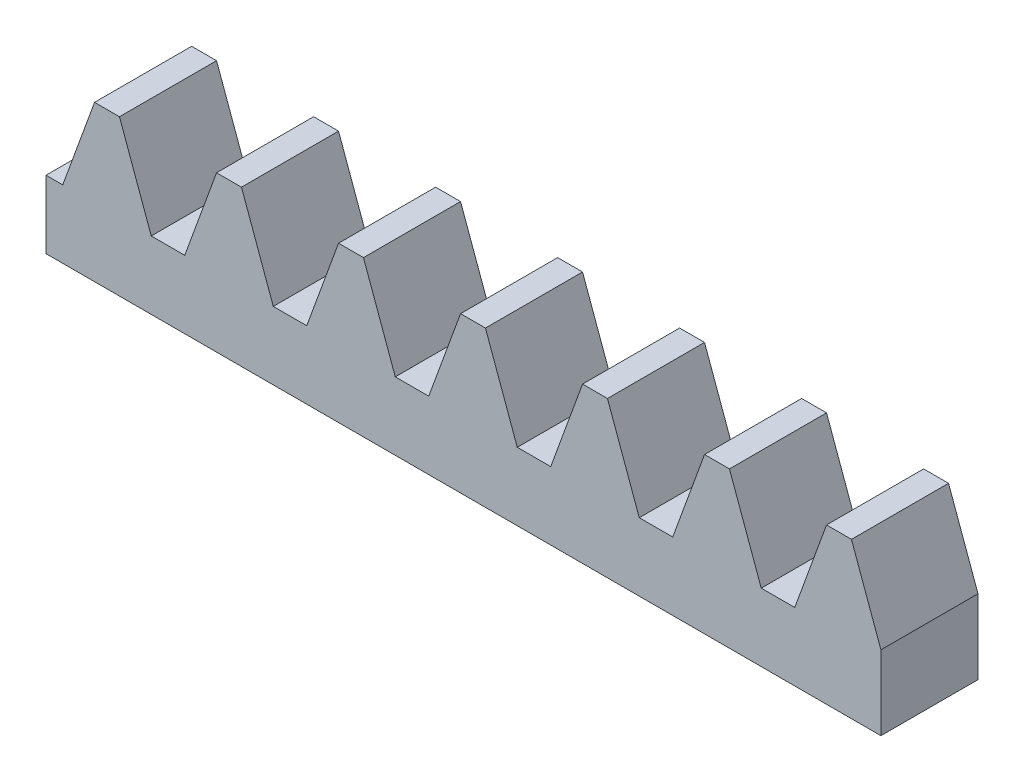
SolidWorks part; units mm, degrees
ref_plane "Plane1" through (0, 0, 0) normal (0, 0, 1) x (1, 0, 0)
ref_plane "Plane2" through (0, 0, 0) normal (0, 1, 0) x (1, 0, 0)
ref_plane "Plane3" through (0, 0, 0) normal (1, 0, 0) x (0, 0, -1)
sketch "HoldingSke" plane through (0, 0, 0) normal (0, 1, 0) x (1, 0, 0)
  line L0 (0, 0) -> (0.0696, 0.4951)
  line L1 (-15, 0) -> (100, 0) construction
  line L2 (0, 0) -> (-2.1039, 2.3779)
  line L3 (0, 0) -> (-11.863, 4.5341)
  line L4 (0, 0) -> (8.552, 1.2019)
  line L5 (0, 0) -> (-23.7986, -8.8762)
  line L6 (0, 0) -> (-10.5278, -7.1032)
  line L9 (-71.009, 38.7566) -> (-30.6022, 53.4635)
  line L10 (-76.2, 4.3779) -> (-70.2, 4.3779)
  line L11 (0, 0) -> (-5, 0)
  line L12 (-76.2, 101.6) -> (-76.133, 101.6)
  line L13 (24.9733, 27.94) -> (52.9518, 28.4284)
  line L14 (24.9733, 27.94) -> (24.9743, 27.94)
  line L15 (24.9733, 27.94) -> (100.4006, 29.5858)
  circle A0 centre (0, 0) radius 19.05
  circle A1 centre (0, 0) radius 3
  circle A2 centre (0, 0) radius 12.7
  dimension "MPH" = 6
  dimension "Diameter" = 38.1
  dimension "Num_teeth" = 8
  dimension "Pitch" = 0.5
  dimension "Width" = 5
  dimension "Show_teeth" = 998
  dimension "Thickness" = 12.7
  dimension "Ap" = 20
  dimension "Pitch_height" = 6
  dimension "Backlash" = 0.067
  dimension "Addendum_fac" = 1
  dimension "Dedendum_fac" = 1.25
  dimension "Clearance_fac" = 0.25
  dimension "Dedendum_add" = 0.001
  dimension "Length" = 43
  dimension "Module" = 2
sketch "BlankSke" plane through (0, 0, 0) normal (0, 0, 1) x (1, 0, 0)
  line L1 (0, 0) -> (43, 0)
  line L2 (0, 0) -> (0, 8)
  line L3 (0, 8) -> (43, 8)
  line L4 (43, 0) -> (43, 8)
  dimension "Length" = 43
  dimension "Blank_height" = 8
extrude "Blank" add sketch "BlankSke" against normal blind 5
sketch "TooCutSkeIll" plane through (0, 0, 0) normal (0, 0, 1) x (1, 0, 0)
  line L0 (-2.4806, 7.9474) -> (-0.9819, 3.8296)
  line L1 (-0.5111, 3.5) -> (0.5111, 3.5)
  line L2 (0.9819, 3.8296) -> (2.4806, 7.9474)
  line L3 (43, 8) -> (0, 8) construction
  line L4 (0, 0) -> (0, 64.897) construction
  line L5 (-13.208, 6) -> (12.954, 6) construction
  line L6 (0, 0) -> (43, 0) construction
  line L7 (1.7718, 6) -> (1.7718, 48.7463) construction
  line L8 (-1.7718, 6) -> (-1.7718, 48.7463) construction
  line L9 (2.5558, 8) -> (2.5558, 8.0254)
  line L10 (-2.5558, 8) -> (-2.5558, 8.0254)
  line L11 (-2.5558, 8.0254) -> (2.5558, 8.0254)
  arc A0 (0.5111, 3.5) -> (0.9819, 3.8296) centre (0.5111, 4.001) ccw
  arc A1 (-0.9819, 3.8296) -> (-0.5111, 3.5) centre (-0.5111, 4.001) ccw
  arc A2 (2.5558, 8) -> (2.4806, 7.9474) centre (2.5558, 7.92) ccw
  arc A3 (-2.4806, 7.9474) -> (-2.5558, 8) centre (-2.5558, 7.92) ccw
  dimension "Root_fillet" = 0.501
  dimension "Break_rad" = 0.08
  dimension "Pitch_height" = 6
  dimension "Gap_width" = 3.5436
  dimension "Dedendum" = 2.5
  dimension "Addendum_plus" = 2.0254
  dimension "Pressure_angle" = 20
extrude "ToothCutIll" [suppressed] cut sketch "TooCutSkeIll" against normal through all
sketch "TooCutSkeSim" plane through (0, 0, 0) normal (0, 0, 1) x (1, 0, 0)
  line L0 (0.8619, 3.5) -> (-0.8619, 3.5)
  line L1 (2.509, 8.0254) -> (0.8619, 3.5)
  line L2 (0, 17.4625) -> (0, 53.467) construction
  line L3 (2.509, 8.0254) -> (-2.509, 8.0254)
  line L6 (-2.509, 8.0254) -> (-0.8619, 3.5)
  line L9 (-1.7718, 6) -> (1.7718, 6) construction
  line L10 (0, 0) -> (43, 0) construction
  line L11 (1.7718, 6) -> (1.7718, 53.467) construction
  line L12 (-1.7718, 6) -> (-1.7718, 53.467) construction
  dimension "Pitch_height" = 6
  dimension "Pressure_angle" = 20
  dimension "Gap_width" = 3.5436
  dimension "Dedendum" = 2.5
  dimension "Addendum_plus" = 2.0254
extrude "ToothCutSim" cut sketch "TooCutSkeSim" against normal through all
pattern_linear "TeethCuts" count 7 spacing 6.2832 along (1, 0, 0) of "ToothCutIll", "ToothCutSim"
equation "' \"Module@HoldingSke\" = 6.35"
equation "' \"Num_teeth@HoldingSke\" = 12"
equation "' \"Ap@HoldingSke\" =  20"
equation "' \"Width@HoldingSke\" = 0.25 * 25.4"
equation "' \"Show_teeth@HoldingSke\" = 500"
equation "' \"Backlash@HoldingSke\" = 0.009 * 25.4"
equation "' \"Addendum_fac@HoldingSke\" = 1.0"
equation "' \"Dedendum_fac@HoldingSke\" = 1.25"
equation "' \"Dedendum_add@HoldingSke\" = 0.00005 * 25.4"
equation "' \"Clearance_fac@HoldingSke\" = 0.25"
equation "' \"Pitch_height@HoldingSke\" = 1 * 25.4"
equation "' \"Length@HoldingSke\" = 4.71 * 25.4"
equation "\"Pitch@HoldingSke\" = 1 / \"Module@HoldingSke\""
equation "\"MPH@HoldingSke\" = \"Dedendum_fac@HoldingSke\" / \"Pitch@HoldingSke\" + 2 * \"Dedendum_add@HoldingSke\" + 0.002 * 25.4"
equation "\"MPH@HoldingSke\" = ((sgn( \"MPH@HoldingSke\" - \"Pitch_height@HoldingSke\")+1)*( \"MPH@HoldingSke\" - \"Pitch_height@HoldingSke\"))/2 + \"Pitch_height@HoldingSke\""
equation "\"Blank_height@BlankSke\" = \"Pitch_height@HoldingSke\" + \"Addendum_fac@HoldingSke\"  / \"Pitch@HoldingSke\" "
equation "\"Length@BlankSke\" =  \"Length@HoldingSke\""
equation "\"Face_width@Blank\" = \"Width@HoldingSke\""
equation "\"Pressure_angle@TooCutSkeIll\" = \"Ap@HoldingSke\""
equation "\"Addendum_plus@TooCutSkeIll\" =  \"Addendum_fac@HoldingSke\"  / \"Pitch@HoldingSke\" + 0.001 *25.4"
equation "\"Dedendum@TooCutSkeIll\" = \"Dedendum_fac@HoldingSke\"  / \"Pitch@HoldingSke\""
equation "\"Pitch_height@TooCutSkeIll\" =  \"MPH@HoldingSke\""
equation "\"Gap_width@TooCutSkeIll\" = 3.14159265 / 2 / \"Pitch@HoldingSke\" + 6 * \"Backlash@HoldingSke\""
equation "\"Pressure_angle@TooCutSkeSim\" = \"Ap@HoldingSke\""
equation "\"Addendum_plus@TooCutSkeSim\" =  \"Addendum_fac@HoldingSke\"  / \"Pitch@HoldingSke\" + 0.001 * 25.4"
equation "\"Dedendum@TooCutSkeSim\" = \"Dedendum_fac@HoldingSke\"  / \"Pitch@HoldingSke\""
equation "\"Pitch_height@TooCutSkeSim\" =  \"MPH@HoldingSke\""
equation "\"Gap_width@TooCutSkeSim\" = 3.14159265 / 2 / \"Pitch@HoldingSke\" + 6 * \"Backlash@HoldingSke\""
equation "\"Root_fillet@TooCutSkeIll\" = \"Clearance_fac@HoldingSke\" / \"Pitch@HoldingSke\" + \"Dedendum_add@HoldingSke\""
equation "\"Break_rad@TooCutSkeIll\" = 0.02 / \"Pitch@HoldingSke\" * 2"
equation "\"Linear_pitch@TeethCuts\" = 3.14159265 / \"Pitch@HoldingSke\""
equation "\"Num_teeth@HoldingSke\" = int( ( \"Length@HoldingSke\" + 0 ) / (3.14159265 / \"Pitch@HoldingSke\")) + 0.9999  + 1"
equation " \"Num_teeth@TeethCuts\" = int( \"Show_teeth@HoldingSke\" ) + 1"
equation " \"Num_teeth@TeethCuts\" = ((sgn( \"Num_teeth@TeethCuts\" - \"Num_teeth@HoldingSke\" )-1)*( \"Num_teeth@TeethCuts\" - \"Num_teeth@HoldingSke\" ))/-2+ \"Num_teeth@HoldingSke\""
equation " \"Num_teeth@TeethCuts\" = ((sgn( \"Num_teeth@TeethCuts\" - 2.0)+1)*( \"Num_teeth@TeethCuts\" - 2.0))/2 +2.0"
